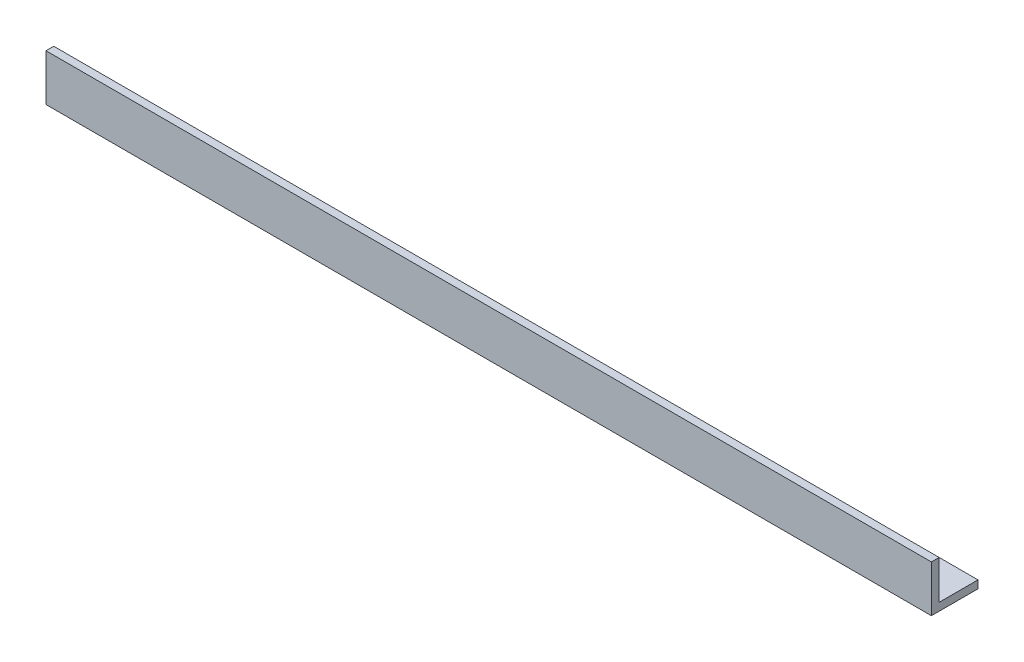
SolidWorks part; units mm, degrees
ref_plane "Front Plane" through (0, 0, 0) normal (0, 0, 1) x (1, 0, 0)
ref_plane "Top Plane" through (0, 0, 0) normal (0, 1, 0) x (1, 0, 0)
ref_plane "Right Plane" through (0, 0, 0) normal (1, 0, 0) x (0, 0, -1)
sketch "Sketch1" plane through (0, 0, 0) normal (1, 0, 0) x (0, 0, -1)
  line L0 (0, 0) -> (0, 38.1)
  line L1 (0, 38.1) -> (6.35, 38.1)
  line L2 (6.35, 38.1) -> (6.35, 6.35)
  line L3 (0, 0) -> (38.1, 0)
  line L4 (38.1, 0) -> (38.1, 6.35)
  line L5 (38.1, 6.35) -> (6.35, 6.35)
  dimension "D1" = 38.1
  dimension "D2" = 38.1
  dimension "D3" = 6.35
  dimension "D4" = 6.35
extrude "Boss-Extrude1" add sketch "Sketch1" along normal blind 723.9
sketch "Sketch2" plane through (0, 0, 0) normal (0, 1, 0) x (1, 0, 0)
  line L0 (0, 0) -> (38.1, 38.1)
  line L1 (723.9, 38.1) -> (0, 38.1) construction
  line L2 (38.1, 38.1) -> (0, 38.1)
  line L3 (0, 38.1) -> (0, 6.35) construction
  line L4 (0, 38.1) -> (0, 0)
  line L5 (723.9, 0) -> (685.8, 38.1)
  line L6 (685.8, 38.1) -> (723.9, 38.1)
  line L7 (723.9, 38.1) -> (723.9, 0)
extrude "Cut-Extrude3" [suppressed] cut sketch "Sketch2" along normal through all
